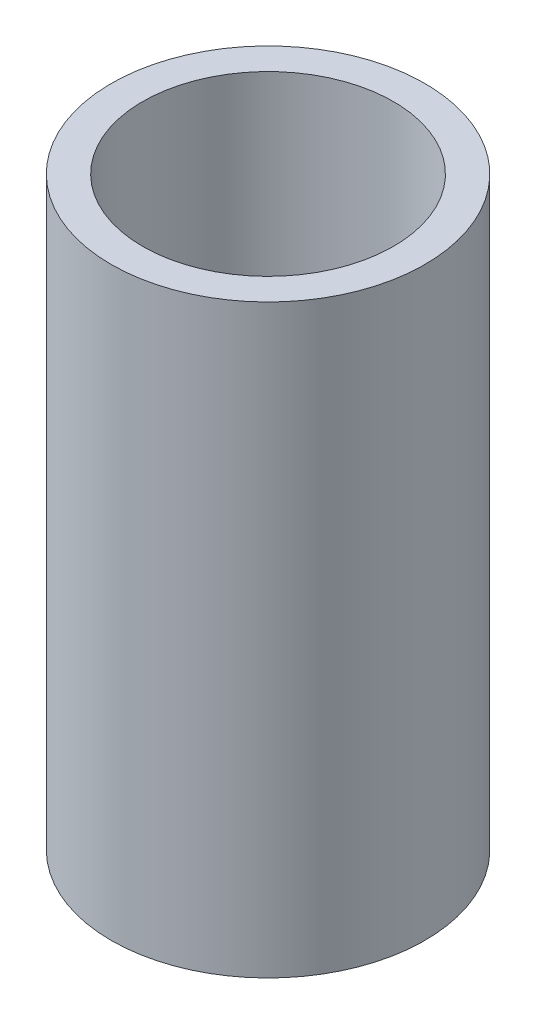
SolidWorks part; units mm, degrees
ref_plane "Front Plane" through (0, 0, 0) normal (0, 0, 1) x (1, 0, 0)
ref_plane "Top Plane" through (0, 0, 0) normal (0, 1, 0) x (1, 0, 0)
ref_plane "Right Plane" through (0, 0, 0) normal (1, 0, 0) x (0, 0, -1)
sketch "Sketch1" plane through (0, 0, 0) normal (0, 1, 0) x (1, 0, 0)
  circle A0 centre (0, 0) radius 6
  circle A1 centre (0, 0) radius 7.5
  dimension "D1" = 15
  dimension "D2" = 12
extrude "Boss-Extrude1" add sketch "Sketch1" along normal mid plane 28
